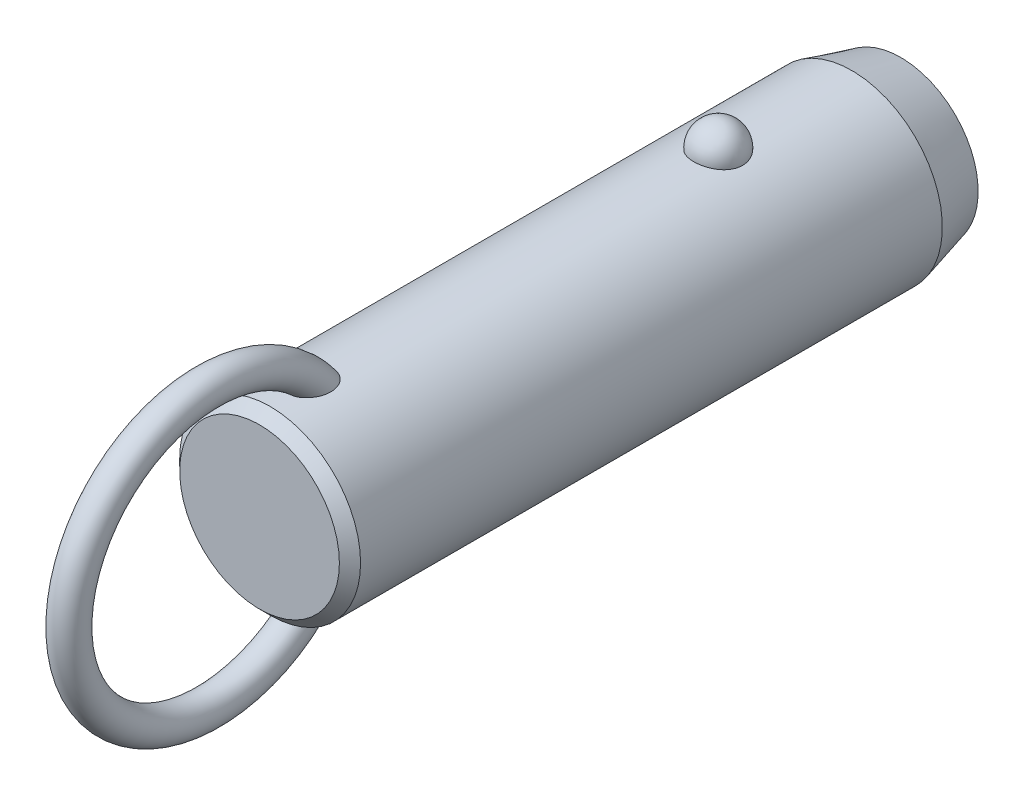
SolidWorks part; units mm, degrees
ref_plane "Front Plane" through (0, 0, 0) normal (0, 0, 1) x (1, 0, 0)
ref_plane "Top Plane" through (0, 0, 0) normal (0, 1, 0) x (1, 0, 0)
ref_plane "Right Plane" through (0, 0, 0) normal (1, 0, 0) x (0, 0, -1)
sketch "Sketch2" plane through (0, 0, 0) normal (0, 0, 1) x (1, 0, 0)
  circle A0 centre (0, 0) radius 11.1
  point P3 (0, 11.1)
  dimension "D1" = 22.2
extrude "Boss-Extrude1" add sketch "Sketch2" along normal blind 40.6
sketch "Sketch3" plane through (0, 0, 0) normal (0, 0, -1) x (-1, 0, 0)
  circle A0 centre (0, 0) radius 11.1
  dimension "D1" = 22.2
extrude "Boss-Extrude2" add sketch "Sketch3" along normal blind 25.4
chamfer "Chamfer1" distance 6 angle 15 1 edges at (-11.1, 0, -25.4)
sketch "Sketch12" plane through (0, 0, 0) normal (1, 0, 0) x (0, 0, -1)
  line L0 (-40.6, 11.1) -> (-40.6, -11.1) construction
  point P0 (-40.6, 0)
sketch "Sketch13" plane through (0, 0, 0) normal (1, 0, 0) x (0, 0, -1)
  circle A0 centre (-59.65, 0) radius 19.05
  point P2 (-40.6, 0)
  dimension "D1" = 38.1
sketch "Sketch14" plane through (0, 0, 0) normal (0, 1, 0) x (1, 0, 0)
  circle A0 centre (0, -42.6) radius 2
  point P2 (0, -40.6)
  dimension "D1" = 4
sweep "Sweep1" add profiles "Sketch14" path "Sketch13"
sketch "Sketch15" plane through (0, 0, 40.6) normal (0, 0, 1) x (1, 0, 0)
  circle A0 centre (0, 0) radius 11.1
  dimension "D1" = 22.2
extrude "Boss-Extrude3" add sketch "Sketch15" along normal blind 12.7
chamfer "Chamfer2" distance 1.3 angle 45 1 edges at (11.1, 0, 53.3)
sketch "Sketch18" plane through (0, 0, 0) normal (1, 0, 0) x (0, 0, -1)
  line L0 (19.4, 11.1) -> (-44.168, 11.1) construction
  line L1 (3, 14.1) -> (3, 8.1)
  line L2 (-44.168, -11.1) -> (19.4, -11.1) construction
  arc A0 (3, 14.1) -> (3, 8.1) centre (3, 11.1) ccw
  point P4 (0, 11.1)
  dimension "D1" = 25.2
revolve "Revolve1" add sketch "Sketch18" angle 360 about L1
